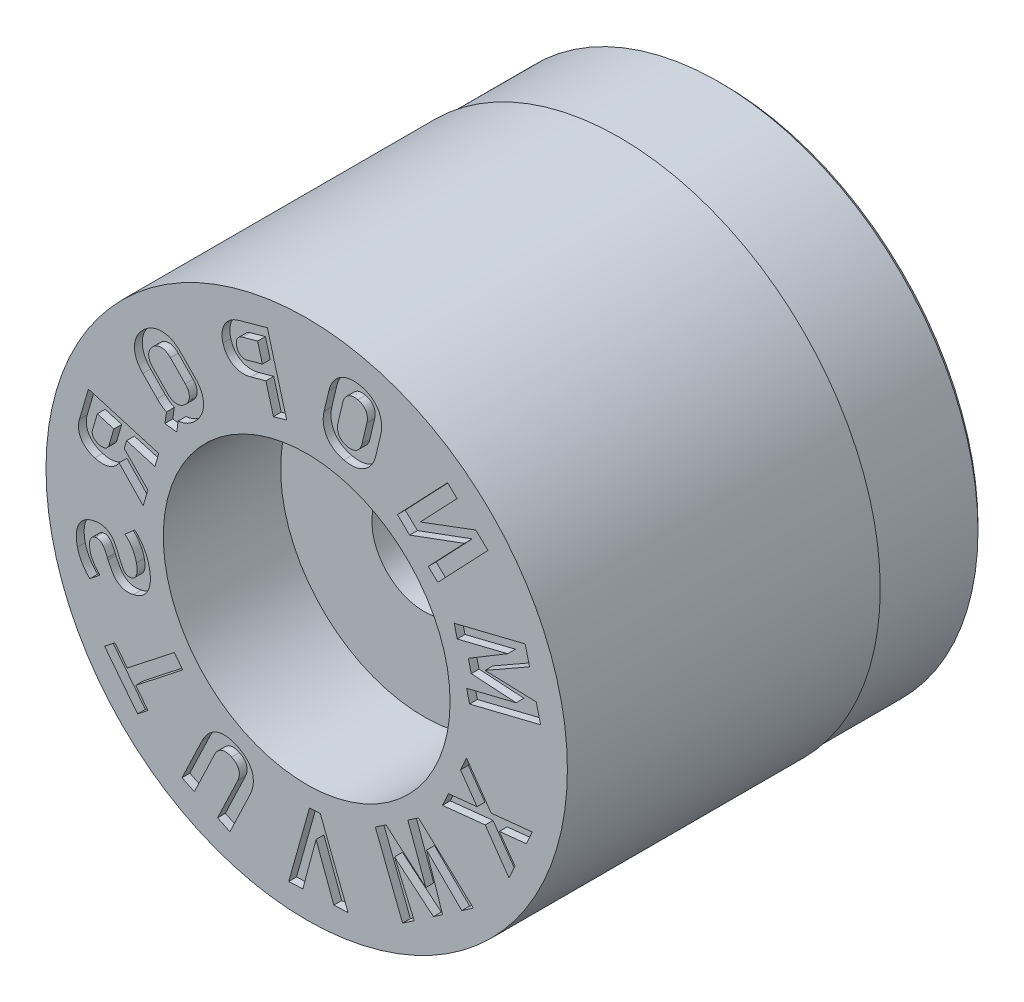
SolidWorks part; units mm, degrees
ref_plane "Front Plane" through (0, 0, 0) normal (0, 0, 1) x (1, 0, 0)
ref_plane "Top Plane" through (0, 0, 0) normal (0, 1, 0) x (1, 0, 0)
ref_plane "Right Plane" through (0, 0, 0) normal (1, 0, 0) x (0, 0, -1)
sketch "Sketch1" plane through (0, 0, 0) normal (1, 0, 0) x (0, 0, -1)
  line L2 (0, 10) -> (0, 5.5)
  line L3 (15.75, 10) -> (0, 10)
  line L4 (-3.7979, 0) -> (49996.2021, 0) construction
  line L8 (16, 2) -> (4.5, 2)
  line L9 (4.5, 5.5) -> (4.5, 2)
  line L10 (4.5, 5.5) -> (0, 5.5)
  line L12 (16, 2) -> (16, 9.75)
  line L16 (16, 9.75) -> (15.75, 10)
  dimension "D1" = 16
  dimension "D2" = 45
  dimension "D3" = 0.25
  dimension "D4" = 20
  dimension "D5" = 11
  dimension "D6" = 4.5
  dimension "D7" = 4
revolve "Revolve1" add sketch "Sketch1" angle 360 about L4
sketch "Sketch4" plane through (0, 0, 0) normal (1, 0, 0) x (0, 0, -1)
  line L0 (0, 0) -> (50000, 0) construction
  line L1 (16, -9.75) -> (16, 9.75) construction
  line L2 (12, 10.935) -> (16, 10.935)
  line L3 (12, 10.935) -> (12, 9.935)
  line L4 (12, 9.935) -> (16, 9.935)
  line L5 (16, 10.935) -> (16, 9.935)
  line L6 (15.75, 10) -> (0, 10) construction
  line L9 (0, 55) -> (0, -55) construction
  dimension "D1" = 1
  dimension "D2" = 0.065
  dimension "D3" = 12
revolve "Cut-Revolve1" cut sketch "Sketch4" angle 360 about L0
sketch "Sketch6" plane through (0, 0, 0) normal (0, 0, 1) x (1, 0, 0)
  line L0 (8.5476, 2.6859) -> (8.3804, 3.362)
  line L1 (8.3804, 3.362) -> (5.6579, 2.6889)
  line L2 (5.6579, 2.6889) -> (5.7732, 2.2228)
  line L3 (5.7732, 2.2228) -> (7.7065, 2.7004)
  line L5 (7.7065, 2.7004) -> (6.2008, 1.7954)
  line L6 (6.2008, 1.7954) -> (6.3125, 1.3421)
  line L7 (6.3125, 1.3421) -> (8.0312, 1.2348)
  line L9 (8.0312, 1.2348) -> (6.1331, 0.7658)
  line L10 (6.1331, 0.7658) -> (6.2484, 0.2996)
  line L11 (6.2484, 0.2996) -> (8.9708, 0.9727)
  line L12 (8.9708, 0.9727) -> (8.8036, 1.6489)
  line L13 (8.8036, 1.6489) -> (6.8407, 1.7132)
  line L14 (6.8407, 1.7132) -> (8.5476, 2.6859)
  line L15 (6.9535, 5.7559) -> (6.4865, 6.1995)
  line L16 (6.4865, 6.1995) -> (4.3576, 5.4021)
  line L18 (4.3576, 5.4021) -> (5.7671, 6.8838)
  line L19 (5.7671, 6.8838) -> (5.4032, 7.2302)
  line L20 (5.4032, 7.2302) -> (3.4797, 5.208)
  line L21 (3.4797, 5.208) -> (3.9485, 4.7622)
  line L22 (3.9485, 4.7622) -> (6.0519, 5.5391)
  line L24 (6.0519, 5.5391) -> (4.6649, 4.0806)
  line L25 (4.6649, 4.0806) -> (5.03, 3.7336)
  line L26 (5.03, 3.7336) -> (6.9535, 5.7559)
  line L27 (2.6558, 6.7654) -> (2.8385, 7.5365)
  line L28 (0.85, 8.008) -> (0.6673, 7.2369)
  line L29 (1.1963, 7.0975) -> (1.3853, 7.8949)
  line L30 (2.3105, 7.6754) -> (2.1215, 6.878)
  line L31 (-1.699, 7.6192) -> (-2.285, 7.4581)
  line L32 (-2.4696, 8.1298) -> (-1.8836, 8.2909)
  line L33 (-2.5912, 8.6231) -> (-1.7414, 8.8566)
  line L34 (-1.5644, 7.1296) -> (-1.2769, 6.0832)
  line L35 (-2.1373, 6.9723) -> (-1.5644, 7.1296)
  line L36 (-6.908, 2.4715) -> (-5.8236, 2.1533)
  line L37 (-1.5097, 8.9202) -> (-2.5912, 8.6231)
  line L38 (-1.8836, 8.2909) -> (-1.699, 7.6192)
  line L39 (-1.2769, 6.0832) -> (-0.7685, 6.2231)
  line L40 (-0.7685, 6.2231) -> (-1.5097, 8.9202)
  line L41 (-6.8833, -5.0676) -> (-7.3542, -4.4669)
  line L42 (-5.376, 4.1926) -> (-5.4389, 3.7774)
  line L43 (-5.4389, 3.7774) -> (-4.9883, 3.717)
  line L44 (-4.9883, 3.717) -> (-4.9294, 4.1125)
  line L45 (-4.2763, 5.8722) -> (-4.8278, 6.438)
  line L46 (-6.2863, 5.0161) -> (-5.7348, 4.4503)
  line L47 (-5.3357, 4.8205) -> (-5.9061, 5.4055)
  line L48 (-5.2275, 6.0672) -> (-4.6571, 5.4822)
  line L49 (-7.3975, 2.6152) -> (-7.583, 1.983)
  line L50 (-8.2173, 2.1693) -> (-8.0318, 2.8013)
  line L53 (-6.9984, 2.1632) -> (-6.908, 2.4715)
  line L55 (-8.3723, 3.4534) -> (-8.7185, 2.2723)
  line L56 (-8.0318, 2.8013) -> (-7.3975, 2.6152)
  line L57 (-5.8236, 2.1533) -> (-5.6746, 2.6617)
  line L58 (-5.6746, 2.6617) -> (-8.3723, 3.4534)
  line L60 (-7.1949, 1.5921) -> (-6.2728, 0.6222)
  line L61 (-6.2728, 0.6222) -> (-6.0924, 1.2378)
  line L62 (-6.0924, 1.2378) -> (-6.9984, 2.1632)
  line L63 (-6.601, -0.3415) -> (-6.9723, -0.6716)
  line L64 (-6.7408, -1.9987) -> (-6.7431, -1.9991)
  line L65 (-7.1756, -1.572) -> (-7.1901, -1.5322)
  line L66 (-8.1773, -0.8217) -> (-8.1796, -0.8221)
  line L67 (-8.319, -2.8209) -> (-7.932, -2.5087)
  line L68 (-8.117, -1.3424) -> (-8.1152, -1.3422)
  line L69 (-6.6425, -2.5106) -> (-6.6389, -2.5102)
  line L71 (-6.558, -5.4824) -> (-4.7543, -4.0679)
  line L72 (-4.7543, -4.0679) -> (-5.0795, -3.6531)
  line L73 (-5.0795, -3.6531) -> (-6.8833, -5.0676)
  line L74 (-7.7538, -4.7807) -> (-6.4872, -6.3962)
  line L75 (-6.4872, -6.3962) -> (-6.0876, -6.0825)
  line L76 (-6.0876, -6.0825) -> (-6.558, -5.4824)
  line L77 (-7.3542, -4.4669) -> (-7.7538, -4.7807)
  line L78 (-4.0178, -6.0582) -> (-4.7827, -7.6638)
  line L79 (-4.7827, -7.6638) -> (-4.3082, -7.8895)
  line L80 (-4.3082, -7.8895) -> (-3.5375, -6.272)
  line L81 (-2.6484, -6.6958) -> (-3.4191, -8.3133)
  line L82 (-3.4191, -8.3133) -> (-2.945, -8.5394)
  line L83 (-2.945, -8.5394) -> (-2.18, -6.9339)
  line L84 (-0.6906, -9.0654) -> (-0.1474, -9.0392)
  line L85 (-0.1474, -9.0392) -> (0.3585, -7.1433)
  line L86 (0.3585, -7.1433) -> (1.0424, -8.9828)
  line L87 (1.0424, -8.9828) -> (1.5857, -8.9572)
  line L88 (1.5857, -8.9572) -> (0.5209, -6.2012)
  line L89 (0.5209, -6.2012) -> (0.1083, -6.221)
  line L90 (0.1083, -6.221) -> (-0.6906, -9.0654)
  line L91 (4.8622, -7.4539) -> (5.2114, -7.2154)
  line L92 (5.2114, -7.2154) -> (4.6002, -5.3753)
  line L93 (4.6002, -5.3753) -> (5.9488, -6.7107)
  line L94 (5.9488, -6.7107) -> (6.3959, -6.4051)
  line L95 (6.3959, -6.4051) -> (4.2878, -4.4624)
  line L96 (4.2878, -4.4624) -> (3.879, -4.742)
  line L97 (3.879, -4.742) -> (4.5713, -6.6333)
  line L98 (4.5713, -6.6333) -> (3.0415, -5.3147)
  line L99 (3.0415, -5.3147) -> (2.6327, -5.5943)
  line L100 (2.6327, -5.5943) -> (3.6778, -8.2636)
  line L101 (3.6778, -8.2636) -> (4.1249, -7.958)
  line L102 (4.1249, -7.958) -> (3.3698, -6.2167)
  line L103 (3.3698, -6.2167) -> (4.8622, -7.4539)
  line L105 (6.848, -3.4157) -> (7.7591, -4.7195)
  line L106 (7.7591, -4.7195) -> (7.9887, -4.2143)
  line L107 (7.9887, -4.2143) -> (7.3902, -3.3595)
  line L109 (7.0767, -2.911) -> (6.1298, -1.5541)
  line L110 (6.1298, -1.5541) -> (5.9002, -2.0593)
  line L111 (5.9002, -2.0593) -> (6.5348, -2.9672)
  line L112 (7.3902, -3.3595) -> (8.4252, -3.2526)
  line L113 (8.4252, -3.2526) -> (8.6548, -2.7475)
  line L114 (8.6548, -2.7475) -> (7.0767, -2.911)
  line L115 (6.5348, -2.9672) -> (5.4365, -3.081)
  line L116 (5.4365, -3.081) -> (5.2069, -3.5862)
  line L117 (5.2069, -3.5862) -> (6.848, -3.4157)
  spline S0 degree 3 poles (1.424, 5.9969) (1.4718, 5.9853) (1.5438, 5.9731) (1.6396, 5.9632) (1.7093, 5.9616) (1.7778, 5.9632) (1.8448, 5.9709) (1.9107, 5.9817) (1.9751, 5.9969) (2.0376, 6.0168) (2.0979, 6.0404) (2.1559, 6.0682) (2.2112, 6.0999) (2.2641, 6.1359) (2.3147, 6.1755) (2.3629, 6.2191) (2.4087, 6.2664) (2.4508, 6.3179) (2.4906, 6.3723) (2.5267, 6.4301) (2.5592, 6.4912) (2.5889, 6.555) (2.624, 6.6457) (2.6446, 6.7167) (2.6558, 6.7654) knots 0 0 0 0 0.090296 0.133688 0.176436 0.218103 0.259215 0.299881 0.340471 0.380424 0.420189 0.458974 0.498245 0.536963 0.576277 0.615913 0.656067 0.696845 0.737839 0.779517 0.821729 0.864647 0.908441 1 1 1 1
  spline S1 degree 3 poles (2.8385, 7.5365) (2.8501, 7.585) (2.8634, 7.6578) (2.8729, 7.7547) (2.875, 7.8252) (2.8734, 7.8941) (2.8668, 7.9616) (2.8561, 8.0278) (2.8409, 8.0928) (2.822, 8.156) (2.7983, 8.2167) (2.7713, 8.2752) (2.7393, 8.3308) (2.7046, 8.3845) (2.6649, 8.4348) (2.6224, 8.4837) (2.5749, 8.5289) (2.5243, 8.5715) (2.4709, 8.6117) (2.4135, 8.6471) (2.3536, 8.6802) (2.2901, 8.7092) (2.2009, 8.7452) (2.1301, 8.7642) (2.0823, 8.7762) knots 0 0 0 0 0.091283 0.135446 0.178505 0.220473 0.261686 0.302628 0.34348 0.38393 0.42343 0.462914 0.501889 0.540945 0.579939 0.619374 0.659521 0.700034 0.740737 0.781715 0.823582 0.866147 0.909556 1 1 1 1
  spline S2 degree 3 poles (2.0823, 8.7762) (2.0344, 8.787) (1.9627, 8.8014) (1.867, 8.8095) (1.7974, 8.8123) (1.729, 8.8092) (1.6617, 8.8033) (1.5959, 8.7915) (1.5316, 8.7757) (1.4688, 8.7567) (1.4087, 8.7321) (1.3505, 8.7049) (1.2954, 8.6727) (1.2422, 8.6375) (1.1915, 8.5979) (1.1438, 8.5536) (1.0981, 8.506) (1.0551, 8.4549) (1.0156, 8.4005) (0.9794, 8.3429) (0.9471, 8.282) (0.9173, 8.2182) (0.8822, 8.1275) (0.8619, 8.0565) (0.85, 8.008) knots 0 0 0 0 0.090202 0.133729 0.176021 0.217862 0.259087 0.299968 0.340298 0.380508 0.420048 0.459329 0.498123 0.537018 0.576339 0.615857 0.65635 0.697214 0.738215 0.779553 0.821771 0.864697 0.908498 1 1 1 1
  spline S3 degree 3 poles (0.6673, 7.2369) (0.6552, 7.1885) (0.6429, 7.1154) (0.6336, 7.0185) (0.6305, 6.948) (0.6331, 6.8789) (0.6397, 6.8111) (0.6505, 6.7446) (0.6654, 6.6797) (0.6852, 6.6168) (0.7078, 6.5558) (0.7358, 6.4979) (0.7669, 6.4422) (0.8017, 6.3885) (0.8419, 6.3383) (0.8844, 6.2892) (0.932, 6.2441) (0.9824, 6.2012) (1.0364, 6.1622) (1.093, 6.1254) (1.1535, 6.0939) (1.2161, 6.0635) (1.306, 6.0295) (1.3758, 6.0079) (1.424, 5.9969) knots 0 0 0 0 0.091393 0.135556 0.178469 0.220603 0.262298 0.303241 0.344093 0.384291 0.424026 0.463296 0.501981 0.541038 0.580347 0.619782 0.65993 0.700443 0.741087 0.7821 0.823958 0.866164 0.909605 1 1 1 1
  spline S4 degree 3 poles (1.5452, 6.5103) (1.5011, 6.5196) (1.439, 6.5434) (1.3634, 6.5864) (1.3152, 6.6259) (1.2735, 6.6704) (1.2391, 6.7202) (1.2116, 6.7743) (1.1925, 6.8331) (1.181, 6.8954) (1.1762, 6.9846) (1.1854, 7.0525) (1.1963, 7.0975) knots 0 0 0 0 0.175121 0.257591 0.338018 0.417081 0.494722 0.573174 0.65287 0.734881 0.819587 1 1 1 1
  spline S5 degree 3 poles (1.3853, 7.8949) (1.3956, 7.94) (1.418, 8.0048) (1.4622, 8.0824) (1.5005, 8.1332) (1.5442, 8.1771) (1.5929, 8.2134) (1.6461, 8.2421) (1.7036, 8.2632) (1.7646, 8.2759) (1.8513, 8.2825) (1.9173, 8.2724) (1.9611, 8.2629) knots 0 0 0 0 0.180352 0.264939 0.347052 0.427421 0.505293 0.582991 0.662149 0.742805 0.824895 1 1 1 1
  spline S6 degree 3 poles (1.9611, 8.2629) (2.0049, 8.2528) (2.0679, 8.231) (2.1427, 8.1866) (2.1912, 8.1474) (2.2325, 8.1027) (2.2679, 8.0535) (2.2943, 7.9987) (2.3144, 7.94) (2.3257, 7.8775) (2.3307, 7.7883) (2.3213, 7.7204) (2.3105, 7.6754) knots 0 0 0 0 0.175039 0.2575 0.33787 0.416876 0.494112 0.572951 0.653116 0.73507 0.819715 1 1 1 1
  spline S7 degree 3 poles (2.1215, 6.878) (2.1112, 6.8329) (2.0887, 6.7681) (2.0446, 6.6905) (2.0063, 6.6397) (1.9627, 6.5956) (1.9134, 6.5599) (1.8602, 6.531) (1.8027, 6.51) (1.7417, 6.4973) (1.655, 6.4907) (1.589, 6.5008) (1.5452, 6.5103) knots 0 0 0 0 0.180292 0.26485 0.346936 0.427278 0.505458 0.58313 0.662262 0.742891 0.824953 1 1 1 1
  spline S8 degree 3 poles (-2.285, 7.4581) (-2.3138, 7.4501) (-2.3576, 7.4434) (-2.4156, 7.4465) (-2.4569, 7.4545) (-2.4965, 7.468) (-2.5331, 7.4883) (-2.5673, 7.5131) (-2.5986, 7.5435) (-2.6266, 7.5783) (-2.6592, 7.6318) (-2.6761, 7.6766) (-2.6845, 7.7077) knots 0 0 0 0 0.169501 0.248728 0.32813 0.406937 0.484765 0.564452 0.646041 0.730952 0.817193 1 1 1 1
  spline S9 degree 3 poles (-2.6845, 7.7077) (-2.6939, 7.7393) (-2.7017, 7.787) (-2.7022, 7.8504) (-2.6962, 7.8948) (-2.6852, 7.9369) (-2.6692, 7.9761) (-2.6473, 8.0118) (-2.6208, 8.0442) (-2.5896, 8.0729) (-2.5407, 8.1055) (-2.4986, 8.1215) (-2.4696, 8.1298) knots 0 0 0 0 0.184831 0.270675 0.355196 0.436121 0.514839 0.59235 0.670842 0.749503 0.829832 1 1 1 1
  spline S10 degree 3 poles (-2.5912, 8.6231) (-2.6704, 8.6004) (-2.7852, 8.5576) (-2.9204, 8.4728) (-3.0078, 8.4) (-3.0838, 8.3189) (-3.145, 8.2283) (-3.1937, 8.1307) (-3.2269, 8.0257) (-3.2468, 7.9153) (-3.2525, 7.7589) (-3.2328, 7.6406) (-3.2112, 7.5629) knots 0 0 0 0 0.179253 0.263504 0.345434 0.425515 0.503835 0.582053 0.661326 0.742115 0.824798 1 1 1 1
  spline S11 degree 3 poles (-3.2112, 7.5629) (-3.1893, 7.4855) (-3.1474, 7.3731) (-3.0619, 7.2423) (-2.989, 7.1572) (-2.906, 7.0855) (-2.8154, 7.0257) (-2.7157, 6.9812) (-2.6092, 6.9497) (-2.4967, 6.9317) (-2.3372, 6.93) (-2.2168, 6.95) (-2.1373, 6.9723) knots 0 0 0 0 0.175255 0.258012 0.33863 0.417861 0.495707 0.573814 0.654276 0.736487 0.82059 1 1 1 1
  spline S12 degree 3 poles (-4.2879, 4.4244) (-4.2524, 4.4585) (-4.2033, 4.5125) (-4.1449, 4.5885) (-4.1054, 4.6457) (-4.0711, 4.7048) (-4.0406, 4.7648) (-4.0154, 4.8264) (-3.9937, 4.8887) (-3.9764, 4.9517) (-3.9651, 5.0153) (-3.9567, 5.0787) (-3.9542, 5.1424) (-3.956, 5.2061) (-3.9624, 5.27) (-3.9735, 5.3338) (-3.989, 5.3975) (-4.0091, 5.4607) (-4.0337, 5.523) (-4.0634, 5.584) (-4.0971, 5.644) (-4.1355, 5.703) (-4.1925, 5.7815) (-4.242, 5.8363) (-4.2763, 5.8722) knots 0 0 0 0 0.090541 0.133853 0.176353 0.218315 0.259315 0.300178 0.340559 0.380521 0.420204 0.459224 0.498061 0.537297 0.576434 0.61602 0.656243 0.696955 0.73802 0.779324 0.82168 0.864469 0.90862 1 1 1 1
  spline S13 degree 3 poles (-4.8278, 6.438) (-4.8624, 6.4736) (-4.9163, 6.5236) (-4.993, 6.583) (-5.0511, 6.6223) (-5.11, 6.658) (-5.1703, 6.6886) (-5.2321, 6.7147) (-5.2948, 6.7368) (-5.3582, 6.7546) (-5.4219, 6.7666) (-5.4855, 6.7756) (-5.5492, 6.7786) (-5.6129, 6.7774) (-5.6766, 6.7717) (-5.7403, 6.7603) (-5.804, 6.7456) (-5.8671, 6.7262) (-5.9291, 6.7018) (-5.9899, 6.673) (-6.0495, 6.6395) (-6.1082, 6.6023) (-6.1854, 6.5452) (-6.2399, 6.4968) (-6.2753, 6.4627) knots 0 0 0 0 0.091249 0.135046 0.178319 0.220143 0.261604 0.302591 0.343408 0.38379 0.423526 0.462578 0.501769 0.540634 0.579726 0.619308 0.659437 0.700032 0.740635 0.781776 0.823648 0.866238 0.909617 1 1 1 1
  spline S14 degree 3 poles (-6.2753, 6.4627) (-6.3105, 6.4285) (-6.36, 6.3752) (-6.4185, 6.2992) (-6.4574, 6.2416) (-6.4923, 6.1829) (-6.5226, 6.1229) (-6.5478, 6.0613) (-6.5695, 5.9991) (-6.5868, 5.936) (-6.5981, 5.8725) (-6.6066, 5.8089) (-6.609, 5.7452) (-6.6072, 5.6814) (-6.601, 5.6177) (-6.589, 5.554) (-6.5737, 5.4902) (-6.5535, 5.427) (-6.5289, 5.3647) (-6.4992, 5.3037) (-6.4655, 5.2437) (-6.4273, 5.1848) (-6.3697, 5.1069) (-6.3208, 5.0519) (-6.2863, 5.0161) knots 0 0 0 0 0.090315 0.133648 0.176463 0.21814 0.259159 0.300042 0.340443 0.380425 0.420127 0.459167 0.498372 0.537278 0.576435 0.616109 0.656352 0.697083 0.738168 0.779493 0.821869 0.86468 0.908576 1 1 1 1
  spline S15 degree 3 poles (-5.7348, 4.4503) (-5.7004, 4.4146) (-5.646, 4.3649) (-5.5698, 4.3049) (-5.5119, 4.2651) (-5.4528, 4.2299) (-5.4071, 4.2066) (-5.3813, 4.1949) (-5.376, 4.1926) knots 0 0 0 0 0.091279 0.135297 0.17829 0.220433 0.261907 0.272491 0.272491 0.272491 0.272491
  spline S16 degree 3 poles (-4.6547, 4.8006) (-4.6867, 4.7694) (-4.7386, 4.7276) (-4.8161, 4.6888) (-4.8749, 4.6691) (-4.9346, 4.657) (-4.9951, 4.6548) (-5.0556, 4.6607) (-5.1153, 4.6765) (-5.1743, 4.6993) (-5.2516, 4.7434) (-5.3036, 4.7874) (-5.3357, 4.8205) knots 0 0 0 0 0.175162 0.257631 0.33759 0.416767 0.494992 0.573271 0.653336 0.735644 0.819774 1 1 1 1
  spline S17 degree 3 poles (-5.9061, 5.4055) (-5.9387, 5.4384) (-5.9806, 5.4922) (-6.023, 5.5705) (-6.0449, 5.63) (-6.0585, 5.6902) (-6.0635, 5.7505) (-6.0589, 5.8106) (-6.0459, 5.8698) (-6.0245, 5.9278) (-5.9829, 6.0038) (-5.9404, 6.0548) (-5.908, 6.086) knots 0 0 0 0 0.180521 0.265138 0.347612 0.427363 0.505905 0.583364 0.662152 0.742378 0.824225 1 1 1 1
  spline S18 degree 3 poles (-5.908, 6.086) (-5.876, 6.1174) (-5.8238, 6.1587) (-5.7465, 6.1983) (-5.6879, 6.2188) (-5.6282, 6.2306) (-5.5679, 6.233) (-5.5077, 6.2268) (-5.4476, 6.2122) (-5.3891, 6.1882) (-5.3115, 6.1446) (-5.2597, 6.1002) (-5.2275, 6.0672) knots 0 0 0 0 0.175169 0.257992 0.338212 0.417391 0.494878 0.573159 0.653065 0.735634 0.819768 1 1 1 1
  spline S19 degree 3 poles (-4.6571, 5.4822) (-4.6244, 5.4494) (-4.5829, 5.3956) (-4.54, 5.3177) (-4.5182, 5.2581) (-4.5047, 5.1977) (-4.4999, 5.1373) (-4.5035, 5.0771) (-4.5169, 5.0178) (-4.538, 4.9592) (-4.5806, 4.8834) (-4.6218, 4.8313) (-4.6547, 4.8006) knots 0 0 0 0 0.180281 0.26414 0.346504 0.42687 0.505308 0.582632 0.661316 0.742137 0.824876 1 1 1 1
  spline S20 degree 3 poles (-7.583, 1.983) (-7.5899, 1.9582) (-7.6059, 1.9236) (-7.6351, 1.8826) (-7.6621, 1.8574) (-7.6918, 1.835) (-7.7252, 1.818) (-7.7618, 1.8054) (-7.8011, 1.7978) (-7.8428, 1.7948) (-7.9024, 1.7953) (-7.9473, 1.8057) (-7.9774, 1.8129) knots 0 0 0 0 0.159909 0.235951 0.312748 0.388947 0.467052 0.545578 0.629447 0.715778 0.806284 1 1 1 1
  spline S21 degree 3 poles (-7.9774, 1.8129) (-8.0072, 1.8215) (-8.0497, 1.8384) (-8.1013, 1.8682) (-8.1346, 1.8936) (-8.1633, 1.9215) (-8.1878, 1.9513) (-8.2065, 1.9837) (-8.2197, 2.0183) (-8.2285, 2.0543) (-8.2303, 2.1055) (-8.2256, 2.1441) (-8.2173, 2.1693) knots 0 0 0 0 0.192685 0.282499 0.368991 0.452129 0.530546 0.607655 0.683707 0.759695 0.836703 1 1 1 1
  spline S22 degree 3 poles (-8.7185, 2.2723) (-8.7394, 2.202) (-8.7587, 2.0948) (-8.7538, 1.9525) (-8.7361, 1.8513) (-8.7034, 1.7552) (-8.6591, 1.6645) (-8.5999, 1.5812) (-8.5283, 1.5051) (-8.4453, 1.436) (-8.3155, 1.3558) (-8.2073, 1.3115) (-8.131, 1.2898) knots 0 0 0 0 0.170771 0.250982 0.330577 0.409002 0.486465 0.564915 0.645788 0.72922 0.815575 1 1 1 1
  spline S23 degree 3 poles (-8.131, 1.2898) (-8.0551, 1.2672) (-7.9403, 1.2451) (-7.7879, 1.2433) (-7.6807, 1.2559) (-7.5792, 1.2817) (-7.4842, 1.3199) (-7.3976, 1.3724) (-7.3185, 1.4364) (-7.25, 1.5101) (-7.2117, 1.5646) (-7.1949, 1.5921) knots 0 0 0 0 0.184424 0.270194 0.353894 0.435054 0.51357 0.591212 0.670062 0.749724 0.824734 0.824734 0.824734 0.824734
  spline S24 degree 3 poles (-6.0397, -1.2923) (-6.0541, -1.2279) (-6.0793, -1.1324) (-6.1248, -1.0093) (-6.1622, -0.9194) (-6.2041, -0.8326) (-6.25, -0.7493) (-6.2999, -0.6697) (-6.3534, -0.5941) (-6.4107, -0.5232) (-6.4897, -0.4355) (-6.5555, -0.3772) (-6.601, -0.3415) knots 0 0 0 0 0.175837 0.262822 0.349569 0.435263 0.519641 0.602963 0.685494 0.766525 0.845735 1 1 1 1
  spline S25 degree 3 poles (-6.9723, -0.6716) (-6.9175, -0.7152) (-6.8406, -0.7883) (-6.7527, -0.9004) (-6.6919, -0.9912) (-6.6387, -1.0878) (-6.5787, -1.2222) (-6.5451, -1.3274) (-6.53, -1.3995) knots 0 0 0 0 0.242002 0.365112 0.491583 0.619468 0.745713 1 1 1 1
  spline S26 degree 3 poles (-6.53, -1.3995) (-6.5219, -1.439) (-6.5106, -1.4971) (-6.5046, -1.5733) (-6.5015, -1.6259) (-6.5046, -1.6755) (-6.5086, -1.7224) (-6.5178, -1.7662) (-6.5295, -1.8071) (-6.545, -1.8445) (-6.5635, -1.8783) (-6.5848, -1.9086) (-6.6097, -1.9349) (-6.6382, -1.9565) (-6.6806, -1.9813) (-6.716, -1.9936) (-6.7408, -1.9987) knots 0 0 0 0 0.170345 0.248768 0.322525 0.392146 0.458336 0.520926 0.580631 0.637412 0.691332 0.743084 0.793147 0.843364 0.893343 1 1 1 1
  spline S27 degree 3 poles (-6.7431, -1.9991) (-6.7759, -2.0073) (-6.8254, -2.0101) (-6.8886, -1.997) (-6.9297, -1.9763) (-6.9665, -1.9489) (-7.0008, -1.9165) (-7.0308, -1.8775) (-7.0588, -1.8332) (-7.0847, -1.7823) (-7.1225, -1.7018) (-7.1499, -1.6374) (-7.1678, -1.5916) knots 0 0 0 0 0.154873 0.225481 0.294573 0.364767 0.436342 0.51113 0.590667 0.677501 0.773863 1 1 1 1
  spline S28 degree 3 poles (-7.1678, -1.5916) (-7.1696, -1.5885) (-7.1718, -1.5818) (-7.1737, -1.575) (-7.1756, -1.572) knots 0 0 0 0 0.513378 1 1 1 1
  spline S29 degree 3 poles (-7.1901, -1.5322) (-7.2223, -1.4515) (-7.2699, -1.3358) (-7.3436, -1.1946) (-7.3947, -1.1033) (-7.4531, -1.0231) (-7.5213, -0.953) (-7.6013, -0.8936) (-7.6754, -0.8522) (-7.7399, -0.8249) (-7.7926, -0.8103) (-7.8484, -0.7993) (-7.9079, -0.7943) (-7.9705, -0.7934) (-8.0612, -0.8004) (-8.1305, -0.8107) (-8.1773, -0.8217) knots 0 0 0 0 0.190688 0.27377 0.349176 0.419846 0.490685 0.562716 0.637627 0.676288 0.715916 0.757466 0.800817 0.846524 0.894704 1 1 1 1
  spline S30 degree 3 poles (-8.1796, -0.8221) (-8.2221, -0.831) (-8.2839, -0.8485) (-8.3626, -0.8788) (-8.4178, -0.9039) (-8.4693, -0.9329) (-8.518, -0.9646) (-8.5632, -1) (-8.6054, -1.0383) (-8.6443, -1.0794) (-8.6795, -1.1233) (-8.711, -1.1702) (-8.7392, -1.2197) (-8.764, -1.2718) (-8.7851, -1.3267) (-8.8021, -1.3843) (-8.817, -1.4443) (-8.8267, -1.5072) (-8.8337, -1.5722) (-8.8371, -1.6396) (-8.8351, -1.7091) (-8.8315, -1.781) (-8.8196, -1.8814) (-8.8063, -1.9575) (-8.7951, -2.0086) knots 0 0 0 0 0.085786 0.126886 0.166772 0.205646 0.243695 0.281573 0.31906 0.356373 0.393394 0.430372 0.467859 0.506064 0.544382 0.5841 0.624825 0.666571 0.709937 0.754031 0.800031 0.847337 0.896481 1 1 1 1
  spline S31 degree 3 poles (-8.7951, -2.0086) (-8.7834, -2.0577) (-8.764, -2.1318) (-8.7273, -2.2278) (-8.6862, -2.3252) (-8.6237, -2.4436) (-8.506, -2.6246) (-8.3986, -2.7472) (-8.319, -2.8209) knots 0 0 0 0 0.158578 0.240052 0.322537 0.490632 0.659706 1 1 1 1
  spline S32 degree 3 poles (-7.932, -2.5087) (-7.9788, -2.4649) (-8.0444, -2.3953) (-8.1221, -2.2952) (-8.1733, -2.2178) (-8.2178, -2.139) (-8.2668, -2.0355) (-8.2922, -1.9549) (-8.3043, -1.9012) knots 0 0 0 0 0.265737 0.396141 0.525535 0.650679 0.771457 1 1 1 1
  spline S33 degree 3 poles (-8.3043, -1.9012) (-8.3127, -1.8641) (-8.322, -1.8094) (-8.33, -1.7379) (-8.3305, -1.6886) (-8.3307, -1.6422) (-8.3258, -1.5986) (-8.3189, -1.5575) (-8.3076, -1.5197) (-8.2944, -1.4847) (-8.277, -1.4538) (-8.2581, -1.4254) (-8.235, -1.4018) (-8.2098, -1.381) (-8.1713, -1.3586) (-8.1395, -1.3465) (-8.117, -1.3424) knots 0 0 0 0 0.172931 0.25263 0.327115 0.397227 0.463619 0.527048 0.586603 0.642956 0.696825 0.748068 0.79744 0.846591 0.896228 1 1 1 1
  spline S34 degree 3 poles (-8.1152, -1.3422) (-8.0795, -1.3349) (-8.0256, -1.3292) (-7.9577, -1.3454) (-7.9137, -1.3673) (-7.8743, -1.3968) (-7.8375, -1.4304) (-7.8053, -1.4698) (-7.7756, -1.5146) (-7.7479, -1.5675) (-7.7026, -1.6544) (-7.6715, -1.7267) (-7.6488, -1.7775) knots 0 0 0 0 0.156601 0.225969 0.295213 0.365012 0.435282 0.507568 0.581527 0.664546 0.762071 1 1 1 1
  spline S35 degree 3 poles (-7.6488, -1.7775) (-7.6463, -1.7821) (-7.6429, -1.7918) (-7.6394, -1.8014) (-7.637, -1.806) knots 0 0 0 0 0.500025 1 1 1 1
  spline S36 degree 3 poles (-7.637, -1.806) (-7.6335, -1.8128) (-7.6281, -1.8271) (-7.6199, -1.84) (-7.6179, -1.8474) knots 0 0 0 0 0.499688 1 1 1 1
  spline S37 degree 3 poles (-7.6179, -1.8474) (-7.5851, -1.9237) (-7.5334, -2.0316) (-7.4586, -2.1652) (-7.4032, -2.2509) (-7.3431, -2.327) (-7.2727, -2.3916) (-7.1938, -2.4474) (-7.1206, -2.4851) (-7.0574, -2.5095) (-7.0063, -2.5228) (-6.9525, -2.5324) (-6.8958, -2.5367) (-6.8363, -2.5371) (-6.7511, -2.5311) (-6.6862, -2.5205) (-6.6425, -2.5106) knots 0 0 0 0 0.189283 0.272896 0.349247 0.421769 0.493576 0.5663 0.641741 0.680714 0.720777 0.761948 0.805281 0.850323 0.897715 1 1 1 1
  spline S38 degree 3 poles (-6.6389, -2.5102) (-6.5971, -2.5006) (-6.5356, -2.4842) (-6.4582, -2.4533) (-6.4038, -2.4283) (-6.3534, -2.398) (-6.3051, -2.3662) (-6.2604, -2.3304) (-6.2193, -2.2913) (-6.1814, -2.2492) (-6.1467, -2.2044) (-6.1158, -2.1565) (-6.0878, -2.106) (-6.0644, -2.0521) (-6.0438, -1.9956) (-6.0273, -1.936) (-6.0137, -1.8739) (-6.0043, -1.8091) (-5.9977, -1.742) (-5.9963, -1.6725) (-5.997, -1.6008) (-6.0023, -1.5268) (-6.0143, -1.4233) (-6.0284, -1.345) (-6.0397, -1.2923) knots 0 0 0 0 0.083814 0.123589 0.162562 0.2006 0.238187 0.275275 0.312129 0.348875 0.385729 0.422592 0.460005 0.498132 0.537237 0.577252 0.618599 0.661216 0.70495 0.750098 0.796789 0.844834 0.894834 1 1 1 1
  spline S39 degree 3 poles (-2.6544, -5.56) (-2.7013, -5.5381) (-2.7715, -5.5078) (-2.8668, -5.4768) (-2.936, -5.4585) (-3.0043, -5.4447) (-3.0717, -5.4359) (-3.138, -5.4325) (-3.203, -5.4327) (-3.2669, -5.438) (-3.3293, -5.4473) (-3.39, -5.4622) (-3.4495, -5.4803) (-3.507, -5.5046) (-3.5631, -5.5329) (-3.6173, -5.5659) (-3.6699, -5.6035) (-3.7207, -5.6455) (-3.7696, -5.6917) (-3.8165, -5.7423) (-3.8611, -5.797) (-3.904, -5.8559) (-3.9582, -5.9423) (-3.9955, -6.0105) (-4.0178, -6.0582) knots 0 0 0 0 0.094194 0.138674 0.181947 0.224162 0.265229 0.305355 0.344703 0.383239 0.421649 0.459213 0.496757 0.534594 0.572418 0.610787 0.649915 0.689661 0.730561 0.772106 0.814807 0.85882 0.904394 1 1 1 1
  spline S40 degree 3 poles (-3.5375, -6.272) (-3.5217, -6.2377) (-3.4939, -6.1897) (-3.4513, -6.1315) (-3.4178, -6.0939) (-3.3819, -6.0614) (-3.3445, -6.0327) (-3.3041, -6.01) (-3.2623, -5.9912) (-3.2184, -5.9782) (-3.1733, -5.9691) (-3.1266, -5.9667) (-3.0789, -5.9682) (-3.0301, -5.9755) (-2.9619, -5.9931) (-2.9111, -6.012) (-2.8779, -6.0283) knots 0 0 0 0 0.141856 0.207486 0.2704 0.330479 0.389063 0.446929 0.503912 0.560922 0.618417 0.676265 0.735974 0.797113 0.861369 1 1 1 1
  spline S41 degree 3 poles (-2.8779, -6.0283) (-2.8443, -6.0443) (-2.7966, -6.0709) (-2.7397, -6.1136) (-2.7026, -6.1469) (-2.6714, -6.1834) (-2.6436, -6.2214) (-2.622, -6.2623) (-2.6041, -6.3049) (-2.5919, -6.3493) (-2.5843, -6.3953) (-2.5819, -6.4425) (-2.5854, -6.4909) (-2.5926, -6.5406) (-2.6119, -6.6101) (-2.6316, -6.6618) (-2.6484, -6.6958) knots 0 0 0 0 0.138954 0.203423 0.26524 0.324979 0.382657 0.440507 0.497622 0.554923 0.612223 0.671218 0.731076 0.793466 0.858574 1 1 1 1
  spline S42 degree 3 poles (-2.18, -6.9339) (-2.1575, -6.8863) (-2.1271, -6.8146) (-2.0947, -6.7179) (-2.0761, -6.6474) (-2.0612, -6.5783) (-2.0517, -6.51) (-2.0467, -6.4429) (-2.046, -6.3769) (-2.0511, -6.3124) (-2.059, -6.2493) (-2.0727, -6.188) (-2.0908, -6.1283) (-2.1137, -6.0701) (-2.1411, -6.0137) (-2.1729, -5.959) (-2.2091, -5.9061) (-2.2498, -5.8552) (-2.2946, -5.806) (-2.3444, -5.7596) (-2.3981, -5.715) (-2.456, -5.6727) (-2.5402, -5.6183) (-2.6074, -5.5818) (-2.6544, -5.56) knots 0 0 0 0 0.095629 0.141115 0.185099 0.227799 0.269322 0.310105 0.349841 0.38901 0.427434 0.465258 0.502887 0.540553 0.578485 0.616567 0.655356 0.694711 0.734828 0.775935 0.818181 0.861387 0.906037 1 1 1 1
  spline S43 degree 3 poles (-4.9294, 4.1125) (-4.9152, 4.1136) (-4.8796, 4.1172) (-4.8229, 4.1274) (-4.7592, 4.1421) (-4.6961, 4.1616) (-4.6341, 4.1859) (-4.5735, 4.2149) (-4.5134, 4.2475) (-4.4553, 4.2856) (-4.3774, 4.3416) (-4.3235, 4.3906) (-4.2879, 4.4244) knots 0.553649 0.553649 0.553649 0.553649 0.579785 0.619379 0.659522 0.70013 0.740746 0.7819 0.823609 0.866408 0.909588 1 1 1 1
extrude "Cut-Extrude1" cut sketch "Sketch6" against normal blind 0.3 contours S10 S11 L35 L34 L39 L40 L37 S8 S9 L32 L38 L31 | L44 S43 S12 L45 S13 S14 L46 S15 L42 L43 L48 S19 S16 L47 S17 S18 | S22 S23 L60 L61 L62 L53 L36 L57 L58 L55 S20 S21 L50 L56 L49 | L28 S3 S0 L27 S1 S2 L30 S7 S4 L29 S5 S6 | L25 L26 L15 L16 L18 L19 L20 L21 L22 L24 | L13 L14 L0 L1 L2 L3 L5 L6 L7 L9 L10 L11 L12 | L116 L117 L105 L106 L107 L112 L113 L114 L109 L110 L111 L115 | L102 L103 L91 L92 L93 L94 L95 L96 L97 L98 L99 L100 L101 | L89 L90 L84 L85 L86 L87 L88 | L83 S42 S39 L78 L79 L80 S40 S41 L81 L82 | L41 L77 L74 L75 L76 L71 L72 L73 | L69 S38 S24 L63 S25 S26 L64 S27 S28 L65 S29 L66 S30 S31 L67 S32 S33 L68 S34 S35 S36 S37
